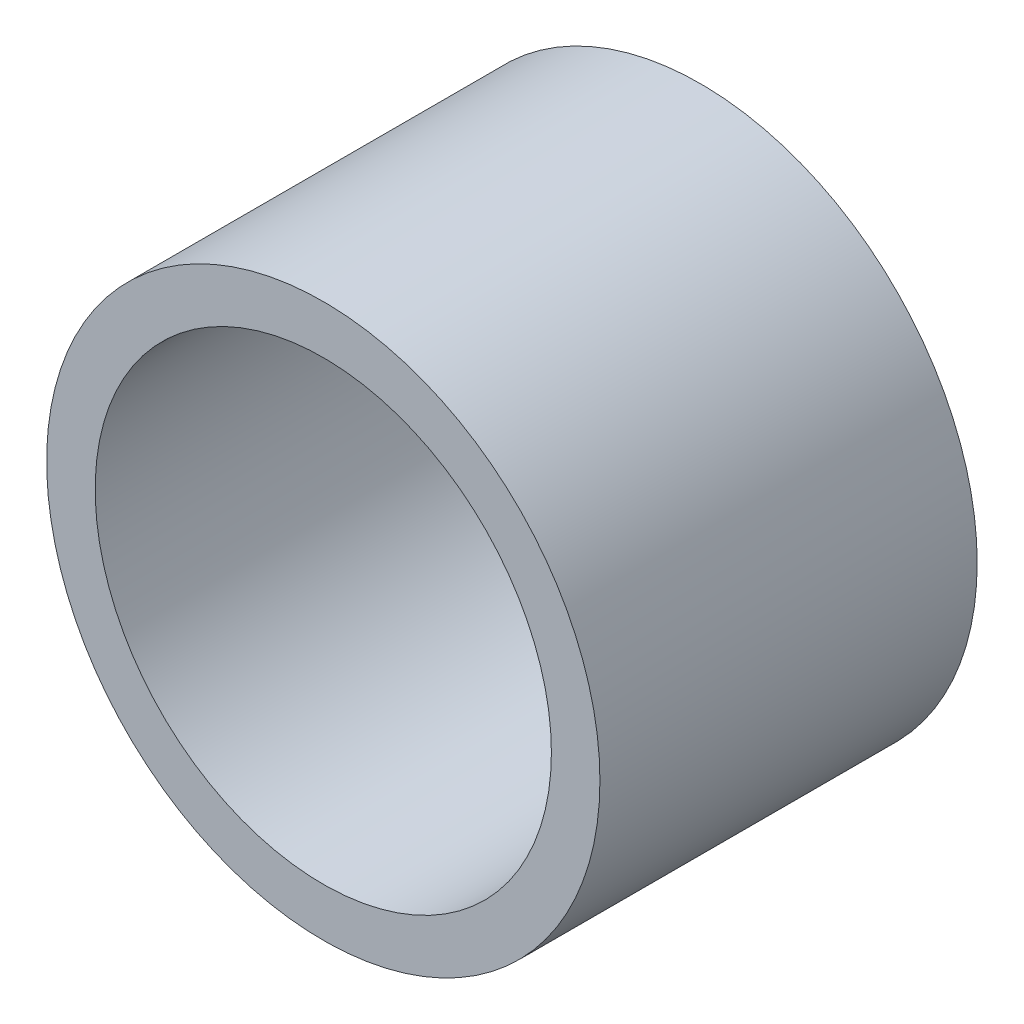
SolidWorks part; units mm, degrees
ref_plane "Front Plane" through (0, 0, 0) normal (0, 0, 1) x (1, 0, 0)
ref_plane "Top Plane" through (0, 0, 0) normal (0, 1, 0) x (1, 0, 0)
ref_plane "Right Plane" through (0, 0, 0) normal (1, 0, 0) x (0, 0, -1)
sketch "Sketch1" plane through (0, 0, 0) normal (0, 0, 1) x (1, 0, 0)
  circle A0 centre (0, 0) radius 11
  circle A1 centre (0, 0) radius 9.07
  dimension "D1" = 22
  dimension "D2" = 18.14
extrude "Boss-Extrude1" add sketch "Sketch1" along normal blind 15
